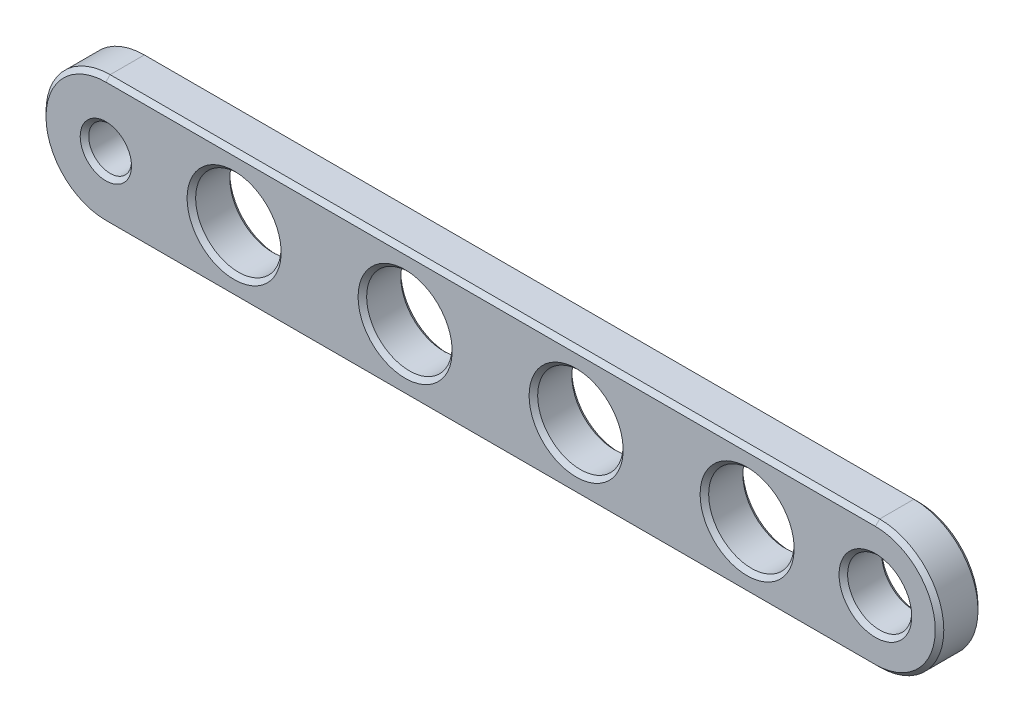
SolidWorks part; units mm, degrees
ref_plane "Front Plane" through (0, 0, 0) normal (0, 0, 1) x (1, 0, 0)
ref_plane "Top Plane" through (0, 0, 0) normal (0, 1, 0) x (1, 0, 0)
ref_plane "Right Plane" through (0, 0, 0) normal (1, 0, 0) x (0, 0, -1)
sketch "Sketch1" plane through (0, 0, 0) normal (0, 0, 1) x (1, 0, 0)
  line L0 (0, 0) -> (0, -7919.8514) construction
  line L1 (0, 0) -> (7919.8514, 0) construction
  line L2 (-17.3468, 3) -> (18.6532, 3)
  line L3 (-17.3468, -3) -> (18.6532, -3)
  circle A0 centre (-17.3468, 0) radius 1
  circle A1 centre (18.6532, 0) radius 1.5
  circle A2 centre (-11.3468, 0) radius 2
  circle A3 centre (-3.3468, 0) radius 2
  circle A4 centre (4.6532, 0) radius 2
  circle A5 centre (12.6532, 0) radius 2
  arc A6 (-17.3468, 3) -> (-17.3468, -3) centre (-17.3468, 0) ccw
  arc A7 (18.6532, 3) -> (18.6532, -3) centre (18.6532, 0) cw
  point P22 (-20.3468, 0)
  point P23 (21.6532, 0)
  dimension "D6" = 4
  dimension "D7" = 4
  dimension "D8" = 4
  dimension "D9" = 4
  dimension "D10" = 3
  dimension "D11" = 2
  dimension "D12" = 3
  dimension "D13" = 3
  dimension "D15" = 21.6532
  dimension "D1" = 36
  dimension "D2" = 6
  dimension "D3" = 8
  dimension "D4" = 6
  dimension "D5" = 8
  dimension "D14" = 20.3468
extrude "Boss-Extrude1" add sketch "Sketch1" along normal blind 2
chamfer "Chamfer1" distance 0.2 angle 45 20 edges at (14.6532, 0, 0) (-1.3468, 0, 0) (20.1532, 0, 0) (0.6532, 3, 0) (-20.3468, 0, 0) (0.6532, -3, 0) (21.6532, 0, 0) (-16.3468, 0, 0) (-9.3468, 0, 0) (6.6532, 0, 0) (14.6532, 0, 2) (6.6532, 0, 2) (-1.3468, 0, 2) (-9.3468, 0, 2) (20.1532, 0, 2) (-16.3468, 0, 2) (0.6532, -3, 2) (-20.3468, 0, 2) (0.6532, 3, 2) (21.6532, 0, 2)
